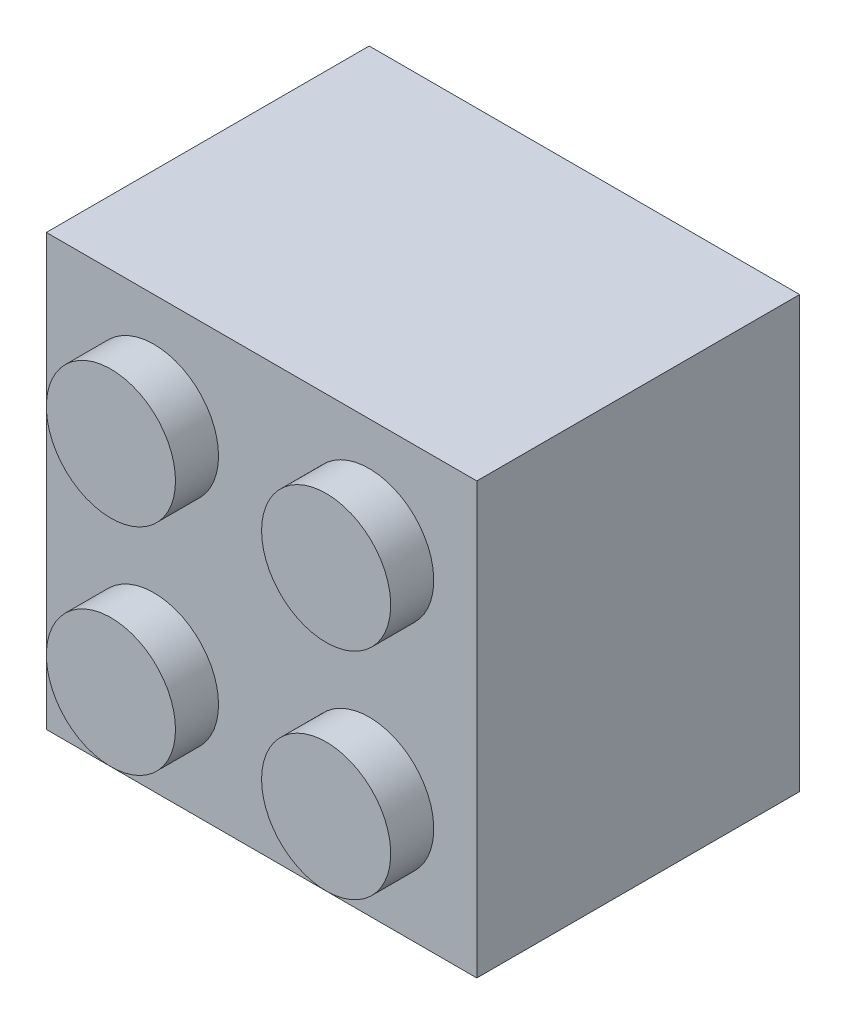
SolidWorks part; units mm, degrees
ref_plane "Front" through (0, 0, 0) normal (0, 0, 1) x (1, 0, 0)
ref_plane "Top" through (0, 0, 0) normal (0, 1, 0) x (1, 0, 0)
ref_plane "Right" through (0, 0, 0) normal (1, 0, 0) x (0, 0, -1)
sketch "Sketch1" plane through (0, 0, 0) normal (0, 0, 1) x (1, 0, 0)
  line L1 (0, 0) -> (-12.7, 0)
  line L2 (0, 0) -> (0, 12.7)
  line L3 (0, 12.7) -> (-12.7, 12.7)
  line L4 (-12.7, 0) -> (-12.7, 12.7)
  dimension "D1" = 12.7
  dimension "D2" = 12.7
extrude "Extrude1" add sketch "Sketch1" along normal blind 19.05
sketch "Sketch2" plane through (0, 0, 19.05) normal (0, 0, 1) x (1, 0, 0)
  line L0 (0, 12.7) -> (-12.7, 0) construction
  circle A0 centre (-6.35, 6.35) radius 3.81
  dimension "D1" = 7.62
extrude "Extrude2" add sketch "Sketch2" along normal blind 2.54
shell "Shell2" thickness 1.27
mirror "Mirror3" about plane through (0, 0, 0) normal (1, 0, 0)
mirror "Mirror4" about plane through (0, 0, 0) normal (0, 1, 0)
